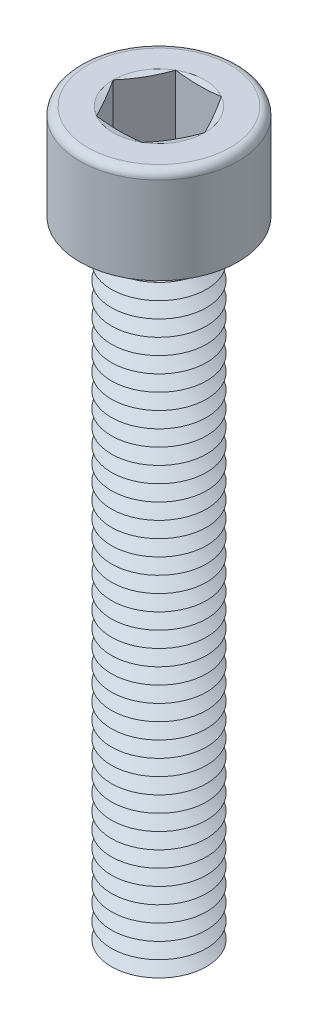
SolidWorks part; units mm, degrees
ref_plane "Front Plane" through (0, 0, 0) normal (0, 0, 1) x (1, 0, 0)
ref_plane "Top Plane" through (0, 0, 0) normal (0, 1, 0) x (1, 0, 0)
ref_plane "Right Plane" through (0, 0, 0) normal (1, 0, 0) x (0, 0, -1)
sketch "Sketch1" plane through (0, 0, 0) normal (0, 1, 0) x (1, 0, 0)
  circle A0 centre (0, 0) radius 3
  dimension "D1" = 6
extrude "Extrude1" add sketch "Sketch1" along normal blind 40
sketch "Sketch2" plane through (0, 40, 0) normal (0, 1, 0) x (1, 0, 0)
  circle A0 centre (0, 0) radius 5
  dimension "D1" = 10
extrude "Extrude2" add sketch "Sketch2" along normal blind 6
sketch "Sketch3" plane through (0, 46, 0) normal (0, 1, 0) x (1, 0, 0)
  line L1 (1.4434, 2.5) -> (-1.4434, 2.5)
  line L2 (-1.4434, 2.5) -> (-2.8868, 0)
  line L3 (-2.8868, 0) -> (-1.4434, -2.5)
  line L4 (-1.4434, -2.5) -> (1.4434, -2.5)
  line L5 (1.4434, -2.5) -> (2.8868, 0)
  line L6 (2.8868, 0) -> (1.4434, 2.5)
  circle A0 centre (0, 0) radius 2.5 construction
  dimension "D1" = 5
extrude "Extrude3" cut sketch "Sketch3" against normal blind 5
fillet "Fillet1" radius 0.5 1 edges at (0, 46, 5)
sketch "Sketch4" plane through (0, 0, 0) normal (1, 0, 0) x (0, 0, -1)
  line L0 (-2.5, 41) -> (0, 41)
  line L1 (0, 41) -> (0, 39.5566)
  line L2 (0, 39.5566) -> (-2.5, 41)
  dimension "D1" = 30
revolve "Cut-Revolve1" cut sketch "Sketch4" angle 360 about L1
sketch "Sketch5" plane through (0, 0, 0) normal (0, 0, 1) x (1, 0, 0)
  line L0 (-3, 0.5) -> (-3, -0.5)
  line L1 (-3, 40) -> (-3, 0) construction
  line L2 (-3, -0.5) -> (-2.134, 0)
  line L3 (-3, 0) -> (3, 0) construction
  line L4 (-2.134, 0) -> (-3, 0.5)
  dimension "D1" = 1
revolve "Cut-Revolve2" cut sketch "Sketch5" angle 360 about axis through (0, 40, 0) along (0, -1, 0)
pattern_linear "LPattern1" count 40 spacing 1 along (0, 1, 0) of "Cut-Revolve2"
sketch "Sketch6" plane through (0, 46, 0) normal (0, 1, 0) x (1, 0, 0)
  circle A0 centre (0, 0) radius 2.8868
extrude "Extrude4" cut sketch "Sketch6" against normal through all draft 75
